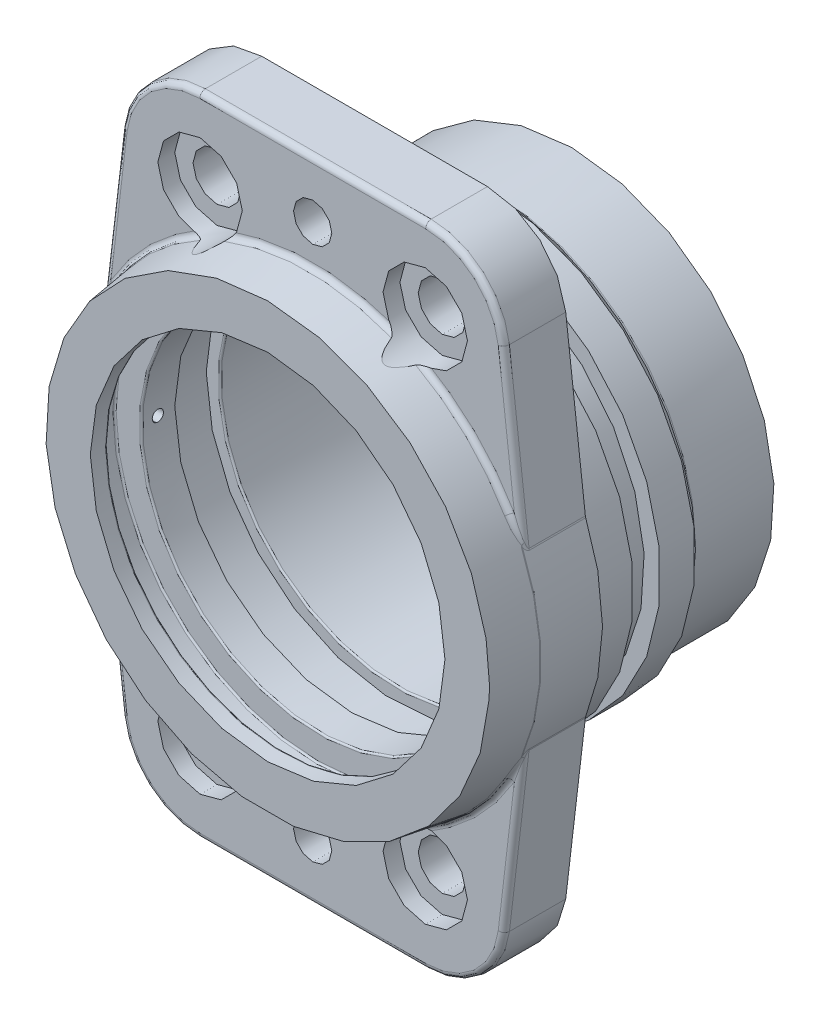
SolidWorks part; units mm, degrees
ref_plane "Face" through (0, 0, 0) normal (0, 0, 1) x (1, 0, 0)
ref_plane "Dessus" through (0, 0, 0) normal (0, 1, 0) x (1, 0, 0)
ref_plane "Droite" through (0, 0, 0) normal (1, 0, 0) x (0, 0, -1)
sketch "Esquisse1" plane through (0, 0, 0) normal (0, 0, 1) x (1, 0, 0)
  line L0 (0, -73.3205) -> (0, 88.7114) construction
  line L1 (-81.0159, 0) -> (84.0086, 0) construction
  line L2 (-20.0515, 57.5) -> (20.0515, 57.5)
  line L3 (-33.9555, 45.1369) -> (-38.7325, 4.5599)
  line L4 (33.9555, 45.1369) -> (38.7325, 4.5599)
  line L5 (33.9555, -45.1369) -> (38.7325, -4.5599)
  line L6 (-20.0515, -57.5) -> (20.0515, -57.5)
  line L7 (-33.9555, -45.1369) -> (-38.7325, -4.5599)
  arc A0 (-38.7325, 4.5599) -> (-38.7325, -4.5599) centre (0, 0) ccw
  arc A1 (-33.9555, 45.1369) -> (-20.0515, 57.5) centre (-20.0515, 43.5) cw
  arc A2 (33.9555, 45.1369) -> (20.0515, 57.5) centre (20.0515, 43.5) ccw
  arc A3 (38.7325, 4.5599) -> (38.7325, -4.5599) centre (0, 0) cw
  arc A4 (33.9555, -45.1369) -> (20.0515, -57.5) centre (20.0515, -43.5) cw
  arc A5 (-33.9555, -45.1369) -> (-20.0515, -57.5) centre (-20.0515, -43.5) ccw
  circle A6 centre (0, 0) radius 30
  point P12 (-32.5, 57.5)
  point P14 (0, 57.5)
  dimension "D2" = 39
  dimension "D4" = 14
  dimension "D5" = 60
  dimension "D1" = 57.5
  dimension "D3" = 32.5
extrude "Extrusion1" add sketch "Esquisse1" along normal blind 14
sketch "Esquisse2" plane through (0, 0, 0) normal (1, 0, 0) x (0, 0, -1)
  line L0 (0, 0) -> (-57, 0) construction
  line L1 (-25, -29.5) -> (-25, -38.1271)
  line L2 (-24.1351, -39.1179) -> (-14, -40.5)
  line L3 (0, -45.1369) -> (0, -4.5599) construction
  line L4 (16.0045, -40.5) -> (-14, -40.5)
  line L5 (17, -39.5) -> (17, -37)
  line L6 (18, -36) -> (34, -36)
  line L7 (35, -35) -> (35, -29.5)
  line L8 (34, -28.5) -> (-24, -28.5)
  line L9 (-14, -45.1369) -> (-14, -4.5599) construction
  arc A0 (-25, -29.5) -> (-24, -28.5) centre (-24, -29.5) cw
  arc A1 (-25, -38.1271) -> (-24.1351, -39.1179) centre (-24, -38.1271) ccw
  arc A3 (17, -39.5) -> (16.0045, -40.5) centre (16, -39.5) cw
  arc A4 (17, -37) -> (18, -36) centre (18, -37) cw
  arc A5 (35, -35) -> (34, -36) centre (34, -35) cw
  arc A6 (34, -28.5) -> (35, -29.5) centre (34, -29.5) cw
  point P14 (-25, -28.5)
  point P17 (-25, -39)
  point P20 (0, -40.5)
  point P25 (17, -36)
  point P28 (35, -36)
  point P31 (35, -28.5)
  dimension "D8" = 1
  dimension "D1" = 40.5
  dimension "D2" = 18
  dimension "D3" = 25
  dimension "D4" = 28.5
  dimension "D5" = 39
  dimension "D6" = 36
  dimension "D7" = 60
revolve "Révolution1" add sketch "Esquisse2" angle 360 about L0
fillet "Congé1" radius 1 20 edges at (-35.7056, -30.271, 0) (-29.3543, -53.9622, 0) (35.7056, -30.271, 0) (29.3543, -53.9622, 0) (-35.7056, -30.271, 14) (-29.3543, -53.9622, 14) (35.7056, -30.271, 14) (29.3543, -53.9622, 14) (35.7056, 30.271, 0) (29.3543, 53.9622, 0) (-35.7056, 30.271, 0) (-29.3543, 53.9622, 0) (35.7056, 30.271, 14) (29.3543, 53.9622, 14) (-35.7056, 30.271, 14) (-29.3543, 53.9622, 14) (0, -57.5, 0) (0, -57.5, 14) (0, 57.5, 0) (0, 57.5, 14)
fillet "Congé2" radius 1 16 edges at (-37.2707, 15.8477, 13.4967) (-37.4557, 15.4052, 7) (-37.4202, 15.4912, 0.7769) (0, 40.5, 0) (37.2707, 15.8477, 0.5033) (37.4557, 15.4052, 7) (37.4202, 15.4912, 13.2231) (37.2707, -15.8477, 13.4967) (37.4557, -15.4052, 7) (37.4202, -15.4912, 0.7769) (0, -40.5, 0) (-37.2707, -15.8477, 0.5033) (-37.4557, -15.4052, 7) (-37.4202, -15.4912, 13.2231) (0, 40.5, 14) (0, -40.5, 14)
fillet "Congé3" radius 1 10 edges at (-37.1036, -16.4623, 13.684) (-37.0911, -16.2718, 13.9758) (-37.1095, 16.4776, 13.6626) (-37.0943, 16.2627, 13.9806) (37.1036, 16.4623, 13.684) (37.0911, 16.2718, 13.9758) (37.1095, -16.4776, 13.6626) (37.0943, -16.2627, 13.9806) (-40.5, 0, 14) (40.5, 0, 14)
hole_wizard "Trou taraudé M8x1.251" positions "Esquisse4" profile "Esquisse3" tap size "M8x1.25" standard "Ansi Métrique"
sketch "Esquisse4" plane through (0, 0, 14) normal (0, 0, 1) x (1, 0, 0)
  line L0 (0, 0) -> (0, 62.6238) construction
  point P0 (0, 47.5)
  point P9 (0, -47.5)
  dimension "D1" = 47.5
  dimension "D2" = 47.5
sketch "Esquisse3" plane through (0, 47.5, 14) normal (1, 0, 0) x (0, -1, 0)
  line L0 (0, 0) -> (0, 21.7929)
  line L1 (0, 21.7929) -> (3.4, 19.75)
  line L2 (3.4, 19.75) -> (3.4, 0)
  line L5 (3.4, 0) -> (0, 0)
  line L10 (0, 21.7929) -> (-3.4, 19.75) construction
  line L11 (0, -6.35) -> (0, 107.95) construction
  dimension "Diamètre du trou pour taraudage" = 6.8
  dimension "Profondeur du trou pour taraudage" = 19.75
  dimension "Angle de pointe" = 118
hole_wizard "Chambrage pour vis à tête ronde bombée M51" positions "Esquisse6" profile "Esquisse5" counterbore size "M5" standard "Ansi Métrique"
sketch "Esquisse6" plane through (0, 0, 14) normal (0, 0, 1) x (1, 0, 0)
  point P0 (-20, 43)
  dimension "D1" = 43
  dimension "D2" = 20
sketch "Esquisse5" plane through (-20, 43, 14) normal (1, 0, 0) x (0, -1, 0)
  line L0 (0, 0) -> (0, 49)
  line L1 (0, 49) -> (4.25, 49)
  line L3 (4.25, 49) -> (4.25, 3)
  line L4 (4.25, 3) -> (7.5, 3)
  line L5 (7.5, 3) -> (7.5, 0)
  line L7 (7.5, 0) -> (0, 0)
  line L11 (0, -6.35) -> (0, 107.95) construction
  dimension "Diamètre du perçage jusqu'au prochain" = 8.5
  dimension "Profondeur du perçage jusqu'au prochain" = 49
  dimension "Diamètre du chambrage" = 15
  dimension "Profondeur du chambrage" = 3
pattern_linear "Répétition linéaire1" count 2 spacing 40 along (1, 0, 0) of "Chambrage pour vis à tête ronde bombée M51"
mirror "Symétrie1" about plane through (0, 0, 0) normal (0, 1, 0) of "Chambrage pour vis à tête ronde bombée M51", "Répétition linéaire1"
sketch "Esquisse7" plane through (0, 0, 14) normal (0, 0, 1) x (1, 0, 0)
  circle A0 centre (20, -43) radius 7.5 construction
  circle A2 centre (20, 43) radius 7.5 construction
  circle A3 centre (-20, 43) radius 7.5 construction
  circle A4 centre (20, -43) radius 7.5
  circle A5 centre (-20, -43) radius 7.5
  circle A6 centre (20, 43) radius 7.5
  circle A7 centre (-20, 43) radius 7.5
extrude "Enlèv. mat.-Extru.1" cut sketch "Esquisse7" along normal blind 90
ref_plane "Plan1" through (-38, 0, 0) normal (1, 0, 0) x (0, 0, -1)
sketch "Esquisse11" plane through (0, 0, 0) normal (0, 1, 0) x (1, 0, 0)
  line L0 (-35.8263, -14) -> (-21.1093, -14) construction
  line L1 (-66.7803, 24.1967) -> (-38, 24.1967)
  line L2 (-66.7803, 24.1967) -> (-66.7803, -3.0024)
  line L3 (-66.7803, -3.0024) -> (-38, -3.0024)
  line L4 (-38, 24.1967) -> (-38, 9.7976)
  line L5 (0, 0) -> (0, -57) construction
  line L6 (-38, 4.9976) -> (-35.15, 4.9976)
  line L7 (-35.15, 4.9976) -> (-35.15, 9.7976)
  line L8 (-35.15, 9.7976) -> (-38, 9.7976)
  line L9 (-38, 4.9976) -> (-38, -3.0024)
  dimension "D1" = 10.9976
  dimension "D2" = 38
  dimension "D3" = 8
  dimension "D4" = 4.8
  dimension "D5" = 35.15
revolve "Enlèvement de matière-Révolution1" cut sketch "Esquisse11" angle 360 about axis through (0, 0, 0) along (0, 0, 1)
sketch "Esquisse13" plane through (0, 0, 0) normal (0, 1, 0) x (1, 0, 0)
  line L0 (0, -39.3084) -> (-52.4386, -39.3084)
  line L1 (0, 0) -> (0, -57) construction
  line L2 (-52.4386, -39.3084) -> (-52.4386, -22.0024)
  line L3 (-52.4386, -22.0024) -> (-31.5, -22.0024)
  line L4 (-31.5, -22.0024) -> (-31.5, -19.0024)
  line L5 (-31.5, -19.0024) -> (-36.2, -19.0024)
  line L6 (-36.2, -19.0024) -> (-36.2, -13.0024)
  line L7 (-36.2, -13.0024) -> (-31.5, -13.0024)
  line L8 (-31.5, -13.0024) -> (-31.5, -7.0024)
  line L9 (-31.5, -7.0024) -> (-33.9, -7.0024)
  line L10 (-33.9, -7.0024) -> (-33.9, 0.9976)
  line L11 (-33.9, 0.9976) -> (-31.5, 0.9976)
  line L12 (-31.5, 0.9976) -> (-31.5, 31.9976)
  line L13 (-31.5, 31.9976) -> (-53.6631, 31.9976)
  line L14 (-53.6631, 31.9976) -> (-53.6631, 40.577)
  line L15 (-53.6631, 40.577) -> (0, 40.577)
  line L16 (0, 40.577) -> (0, -39.3084)
  line L17 (20.0515, -3.0024) -> (-20.0515, -3.0024) construction
  dimension "D1" = 19
  dimension "D2" = 35
  dimension "D3" = 31.5
  dimension "D4" = 33.9
  dimension "D5" = 36.2
  dimension "D6" = 3
  dimension "D7" = 6
  dimension "D8" = 15
  dimension "D9" = 8
revolve "Enlèvement de matière-Révolution2" cut sketch "Esquisse13" angle 360 about L16
sketch "Esquisse9" plane through (-38, 0, 0) normal (1, 0, 0) x (0, 0, -1)
  line L0 (0, 0) -> (-57, 0) construction
  line L2 (-3.0024, 15.5407) -> (-3.0024, 45.1369) construction
  circle A0 centre (-10.0024, 0) radius 1
  dimension "D1" = 2
  dimension "D2" = 7
extrude "Enlèv. mat.-Extru.2" cut sketch "Esquisse9" along normal up to next
sketch "Esquisse10" plane through (-38, 0, 0) normal (1, 0, 0) x (0, 0, -1)
  circle A0 centre (-10.0024, 0) radius 4
  dimension "D1" = 8
extrude "Enlèv. mat.-Extru.3" cut sketch "Esquisse10" against normal through all
chamfer "Chanfrein1" distance 2 angle 30 1 edges at (-31.5, 0, -31.9976)
chamfer "Chanfrein2" distance 1 angle 45 1 edges at (0, -38, -17)
fillet "Congé4" radius 0.3 4 edges at (-36.2, 0, 13.0024) (-31.5, 0, 19.0024) (-31.5, 0, 13.0024) (-31.5, 0, -0.9976)
